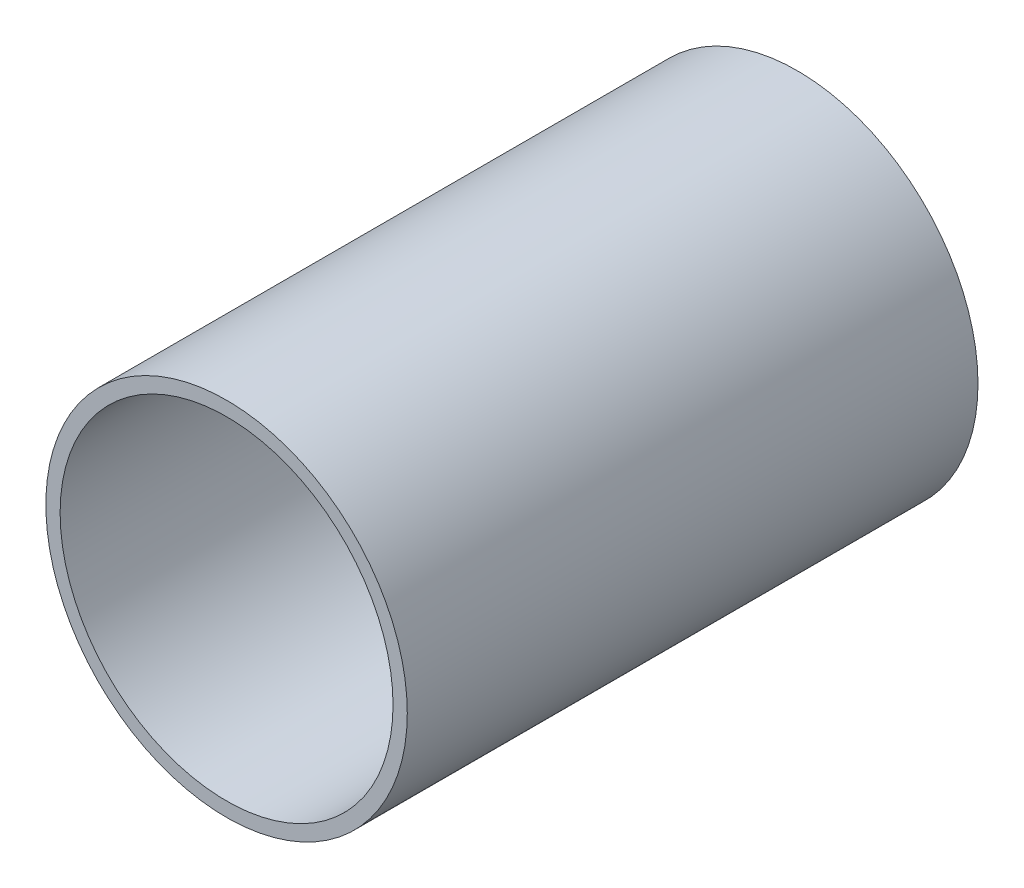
SolidWorks part; units mm, degrees
ref_plane "face" through (0, 0, 0) normal (0, 0, 1) x (1, 0, 0)
ref_plane "dessus" through (0, 0, 0) normal (0, 1, 0) x (1, 0, 0)
ref_plane "profil" through (0, 0, 0) normal (1, 0, 0) x (0, 0, -1)
sketch "Esquisse1" plane through (0, 0, 0) normal (0, 0, 1) x (1, 0, 0)
  circle A0 centre (0, 0) radius 19
  circle A1 centre (0, 0) radius 17.5
  dimension "D1" = 38
  dimension "D2" = 35
extrude "Base-Extrusion" add sketch "Esquisse1" along normal blind 60
